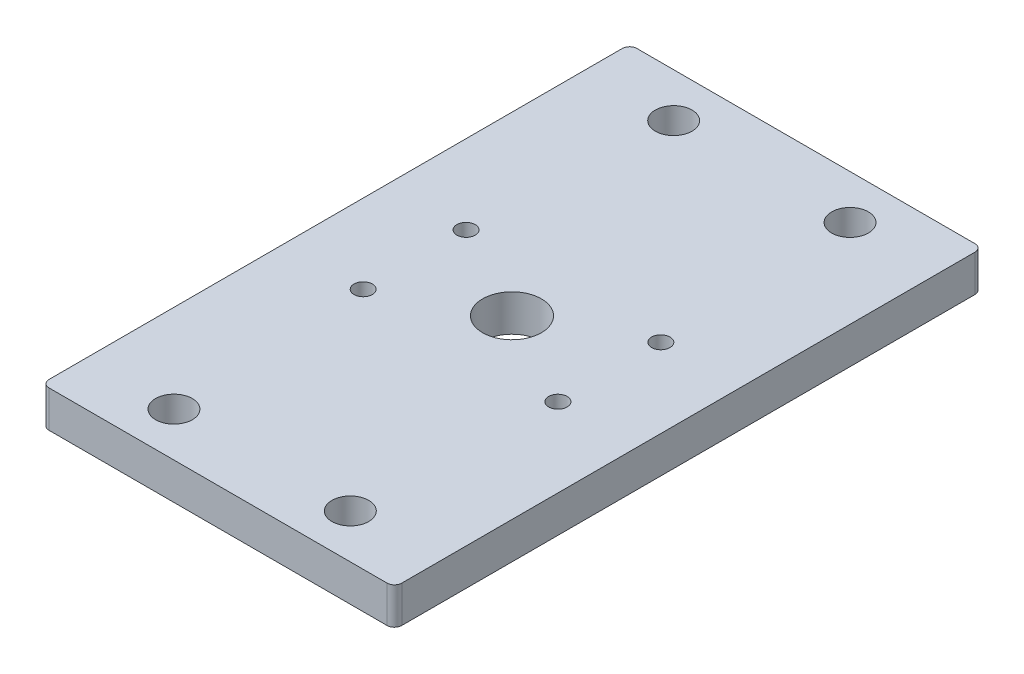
SolidWorks part; units mm, degrees
ref_plane "front" through (0, 0, 0) normal (0, 0, 1) x (1, 0, 0)
ref_plane "top" through (0, 0, 0) normal (0, 1, 0) x (1, 0, 0)
ref_plane "side" through (0, 0, 0) normal (1, 0, 0) x (0, 0, -1)
sketch "Sketch2" plane through (0, 0, 0) normal (0, 1, 0) x (1, 0, 0)
  line L0 (152.4, 0) -> (-152.4, 0)
  line L1 (152.4, 0) -> (152.4, -508)
  line L2 (-152.4, -508) -> (152.4, -508)
  line L3 (-152.4, -508) -> (-152.4, 0)
  line L4 (0, 0) -> (0, -508) construction
  dimension "D1" = 508
  dimension "D2" = 304.8
extrude "Base-Extrude" add sketch "Sketch2" along normal blind 31.75
sketch "Sketch3" plane through (0, 31.75, 0) normal (0, 1, 0) x (-1, 0, 0)
  line L0 (-152.4, 254) -> (0, 254) construction
  line L1 (-152.4, 0) -> (-152.4, 508) construction
  line L2 (0, 0) -> (0, 254) construction
  circle A0 centre (0, 254) radius 25.4
  dimension "D1" = 50.8
extrude "Cut-Extrude1" cut sketch "Sketch3" against normal through all
sketch "Sketch4" plane through (0, 0, 0) normal (0, -1, 0) x (1, 0, 0)
  line L0 (-76.2, 469.9) -> (76.2, 469.9) construction
  line L1 (76.2, 469.9) -> (76.2, 38.1) construction
  line L2 (76.2, 38.1) -> (-76.2, 38.1) construction
  line L3 (-76.2, 38.1) -> (-76.2, 469.9) construction
  line L4 (-84.1375, 298.45) -> (84.1375, 298.45) construction
  line L5 (84.1375, 298.45) -> (84.1375, 209.55) construction
  line L6 (84.1375, 209.55) -> (-84.1375, 209.55) construction
  line L7 (-84.1375, 209.55) -> (-84.1375, 298.45) construction
  circle A4 centre (-76.2, 38.1) radius 15.875
  circle A5 centre (76.2, 38.1) radius 15.875
  circle A6 centre (-76.2, 469.9) radius 15.875
  circle A7 centre (76.2, 469.9) radius 15.875
  circle A12 centre (-84.1375, 209.55) radius 7.9375
  circle A13 centre (-84.1375, 298.45) radius 7.9375
  circle A14 centre (84.1375, 298.45) radius 7.9375
  circle A15 centre (84.1375, 209.55) radius 7.9375
  circle A16 centre (0, 254) radius 25.4 construction
  dimension "D9" = 31.75
  dimension "D10" = 15.875
  dimension "D1" = 431.8
  dimension "D2" = 152.4
  dimension "D3" = 88.9
  dimension "D4" = 168.275
  dimension "D5" = 44.45
  dimension "D6" = 215.9
  dimension "D7" = 76.2
  dimension "D8" = 84.1375
extrude "Cut-Extrude2" cut sketch "Sketch4" against normal through all
fillet "Fillet1" radius 6.35 4 edges at (152.4, 15.875, 0) (-152.4, 15.875, 0) (-152.4, 15.875, 508) (152.4, 15.875, 508)
